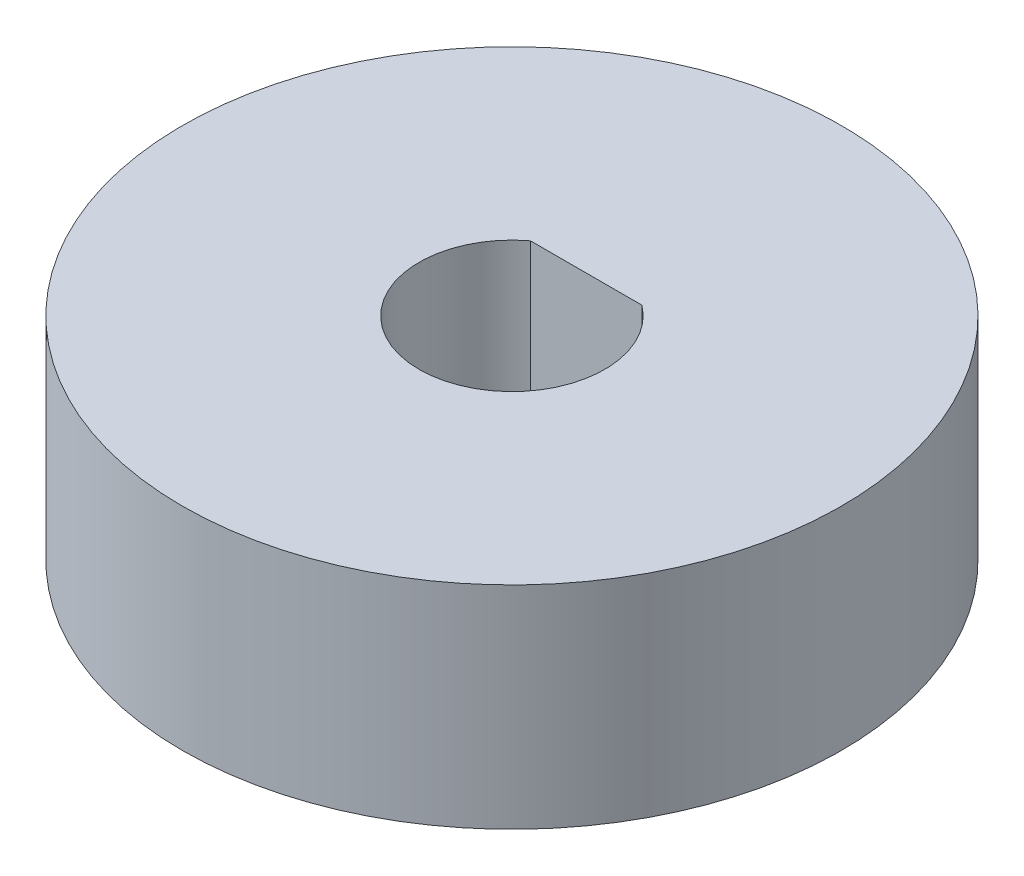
SolidWorks part; units mm, degrees
ref_plane "Front Plane" through (0, 0, 0) normal (0, 0, 1) x (1, 0, 0)
ref_plane "Top Plane" through (0, 0, 0) normal (0, 1, 0) x (1, 0, 0)
ref_plane "Right Plane" through (0, 0, 0) normal (1, 0, 0) x (0, 0, -1)
sketch "Sketch1" plane through (0, 0, 0) normal (0, 1, 0) x (1, 0, 0)
  line L4 (1.8425, 2.4556) -> (-1.8425, 2.4556)
  circle A0 centre (0, 0) radius 10.9
  arc A1 (-1.8425, 2.4556) -> (1.8425, 2.4556) centre (0, 0) ccw
  dimension "D1" = 2.4556
  dimension "D2" = 3.07
  dimension "D3" = 21.8
extrude "Extrude1" add sketch "Sketch1" along normal blind 7
